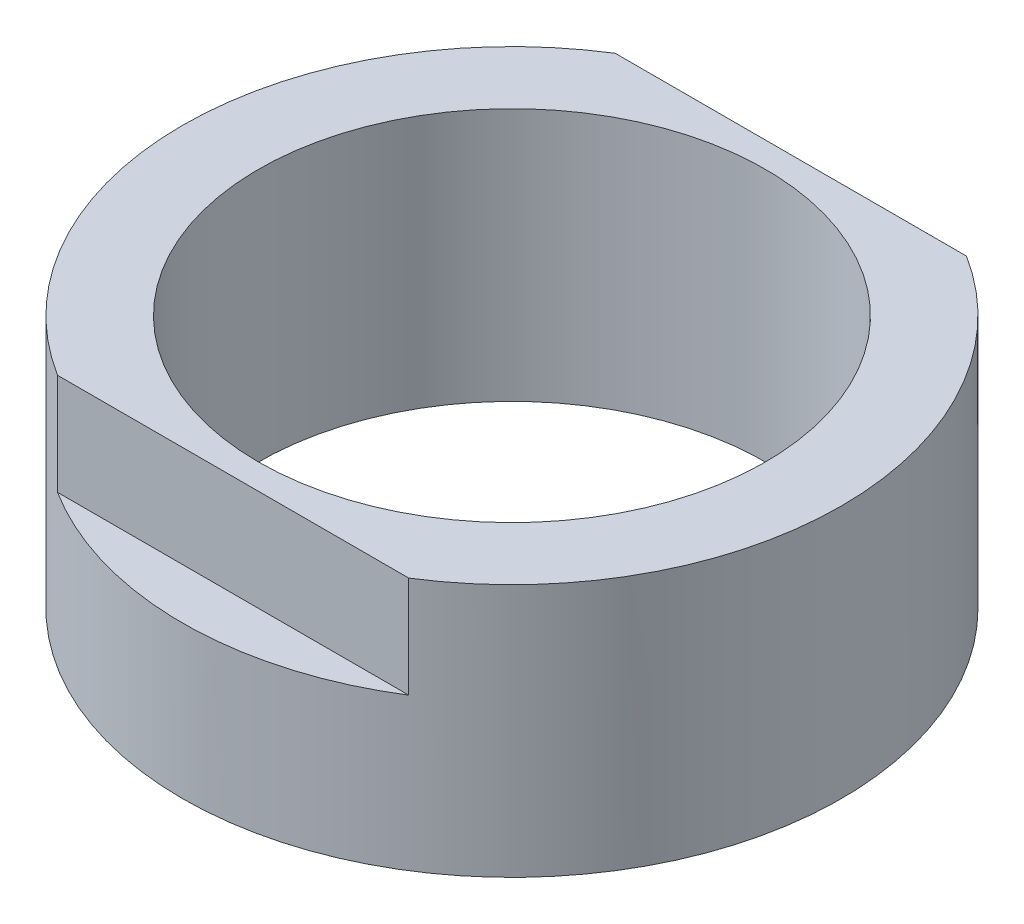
SolidWorks part; units mm, degrees
ref_plane "Front Plane" through (0, 0, 0) normal (0, 0, 1) x (1, 0, 0)
ref_plane "Top Plane" through (0, 0, 0) normal (0, 1, 0) x (1, 0, 0)
ref_plane "Right Plane" through (0, 0, 0) normal (1, 0, 0) x (0, 0, -1)
sketch "Sketch1" plane through (0, 0, 0) normal (0, 1, 0) x (1, 0, 0)
  circle A0 centre (0, 0) radius 6.5
  dimension "D1" = 13
extrude "Boss-Extrude1" add sketch "Sketch1" along normal blind 5
sketch "Sketch2" plane through (0, 5, 0) normal (0, 1, 0) x (1, 0, 0)
  line L0 (0, 0) -> (0, 5.5) construction
  line L1 (-5.6685, 8.5) -> (5.6685, 8.5)
  line L2 (-5.6685, 8.5) -> (-5.6685, 5.5)
  line L3 (-5.6685, 5.5) -> (5.6685, 5.5)
  line L4 (5.6685, 8.5) -> (5.6685, 5.5)
  line L5 (-5.4017, -5.5) -> (5.4017, -5.5)
  line L6 (-5.4017, -5.5) -> (-5.4017, -8.5)
  line L7 (-5.4017, -8.5) -> (5.4017, -8.5)
  line L8 (5.4017, -5.5) -> (5.4017, -8.5)
  line L9 (0, 0) -> (0, -5.5) construction
  dimension "D1" = 11
  dimension "D2" = 3
  dimension "D3" = 3
extrude "Cut-Extrude1" cut sketch "Sketch2" against normal blind 2
sketch "Sketch3" plane through (0, 5, 0) normal (0, 1, 0) x (1, 0, 0)
  circle A0 centre (0, 0) radius 5
  dimension "D1" = 10
extrude "Cut-Extrude2" cut sketch "Sketch3" against normal through all
